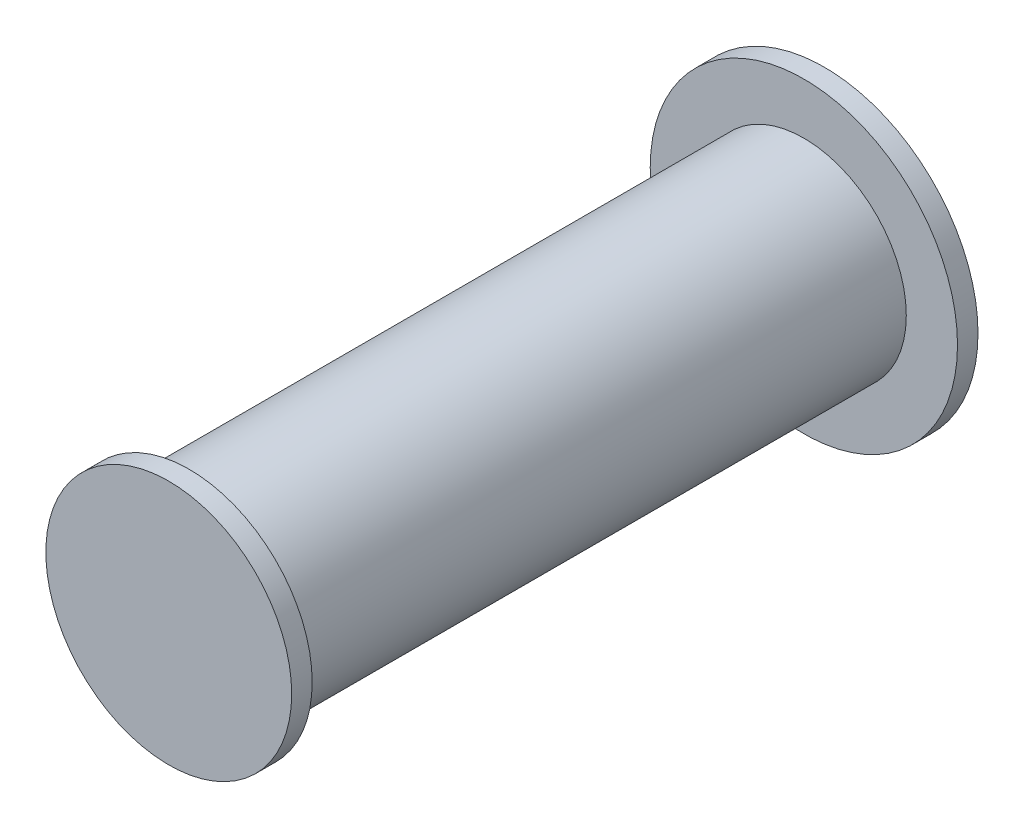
SolidWorks part; units mm, degrees
ref_plane "Front Plane" through (0, 0, 0) normal (0, 0, 1) x (1, 0, 0)
ref_plane "Top Plane" through (0, 0, 0) normal (0, 1, 0) x (1, 0, 0)
ref_plane "Right Plane" through (0, 0, 0) normal (1, 0, 0) x (0, 0, -1)
sketch "Sketch1" plane through (0, 0, 0) normal (0, 0, 1) x (1, 0, 0)
  circle A0 centre (0, 0) radius 75
  dimension "D1" = 150
extrude "Boss-Extrude1" add sketch "Sketch1" along normal blind 10
sketch "Sketch2" plane through (0, 0, 10) normal (0, 0, 1) x (1, 0, 0)
  circle A0 centre (0, 0) radius 50
extrude "Boss-Extrude2" add sketch "Sketch2" along normal blind 300
sketch "Sketch3" plane through (0, 0, 310) normal (0, 0, 1) x (1, 0, 0)
  circle A2 centre (0, 0) radius 60
  circle A3 centre (0, 0) radius 60
  dimension "D1" = 10
extrude "Boss-Extrude3" add sketch "Sketch3" along normal blind 10
